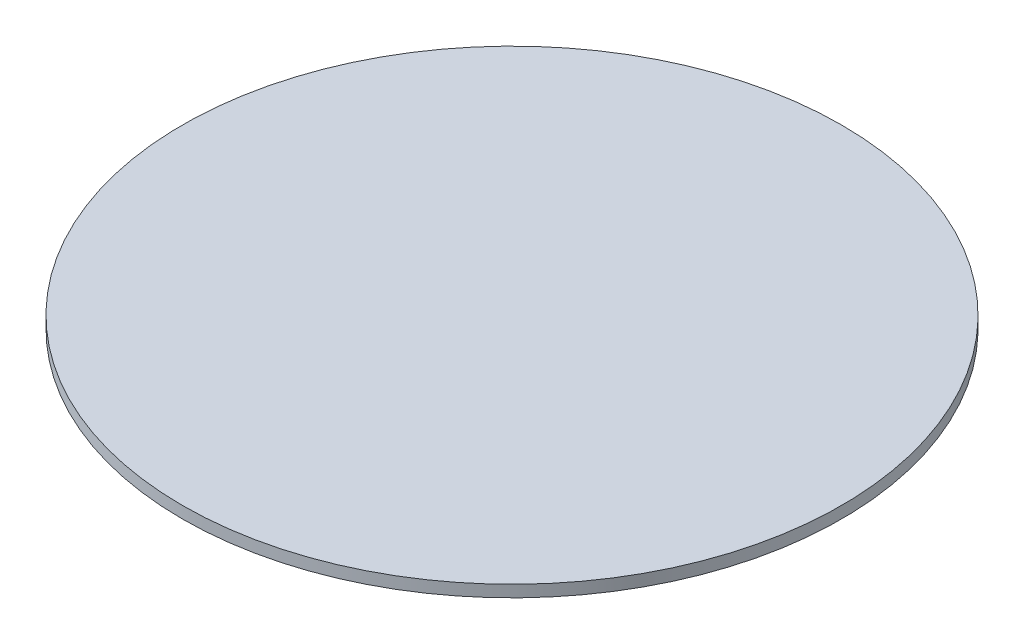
SolidWorks part; units mm, degrees
ref_plane "Front Plane" through (0, 0, 0) normal (0, 0, 1) x (1, 0, 0)
ref_plane "Top Plane" through (0, 0, 0) normal (0, 1, 0) x (1, 0, 0)
ref_plane "Right Plane" through (0, 0, 0) normal (1, 0, 0) x (0, 0, -1)
sketch "Sketch1" plane through (0, 0, 0) normal (0, 1, 0) x (1, 0, 0)
  circle A0 centre (0, 0) radius 44.45
  dimension "D1" = 88.9
extrude "Boss-Extrude1" add sketch "Sketch1" along normal blind 1.5875
